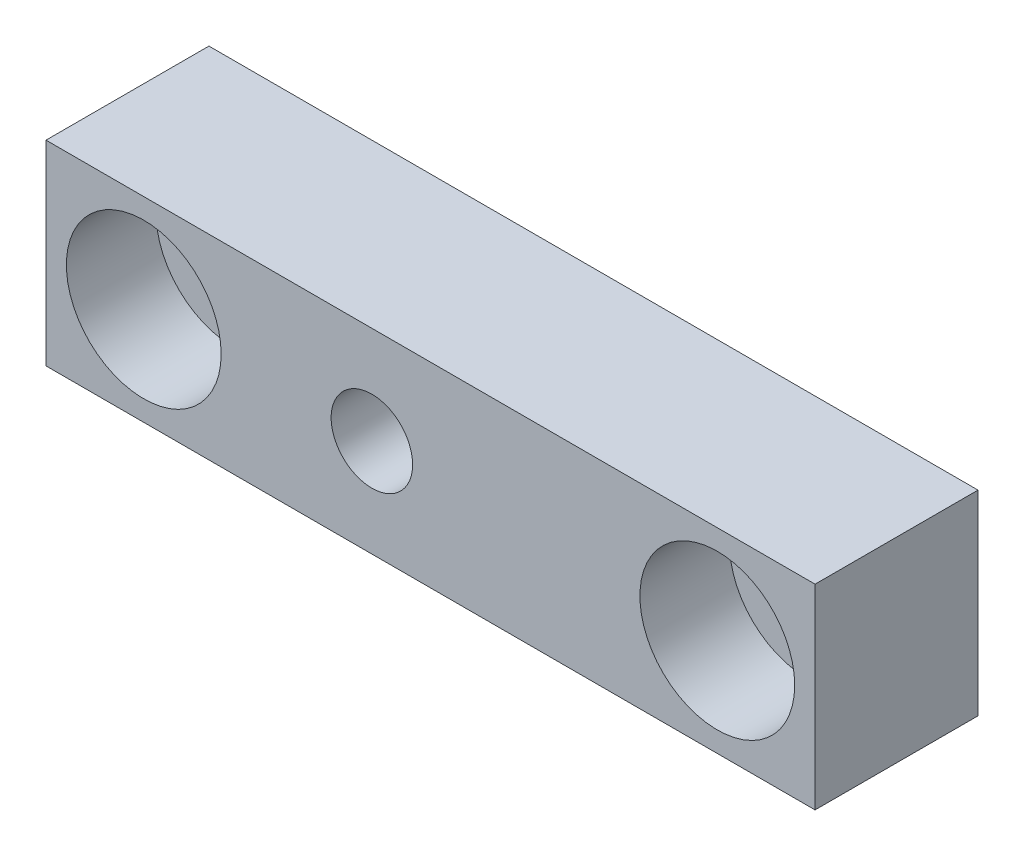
SolidWorks part; units mm, degrees
ref_plane "前视基准面" through (0, 0, 0) normal (0, 0, 1) x (1, 0, 0)
ref_plane "上视基准面" through (0, 0, 0) normal (0, 1, 0) x (1, 0, 0)
ref_plane "右视基准面" through (0, 0, 0) normal (1, 0, 0) x (0, 0, -1)
sketch "草图1" plane through (0, 0, 0) normal (0, 0, 1) x (1, 0, 0)
  line L0 (0, 0) -> (47.2, 0)
  line L1 (0, 12) -> (47.2, 12)
  line L2 (0, 0) -> (0, 12)
  line L3 (47.2, 0) -> (47.2, 12)
  circle A0 centre (41.2, 6) radius 2.75
  circle A1 centre (6, 6) radius 2.75
  circle A2 centre (20, 6) radius 2.5
extrude "凸台-拉伸1" add sketch "草图1" along normal blind 10
sketch "草图2" plane through (0, 0, 10) normal (0, 0, 1) x (1, 0, 0)
  circle A0 centre (41.2, 6) radius 4.75
  circle A1 centre (6, 6) radius 4.75
extrude "切除-拉伸1" cut sketch "草图2" against normal blind 5.5
